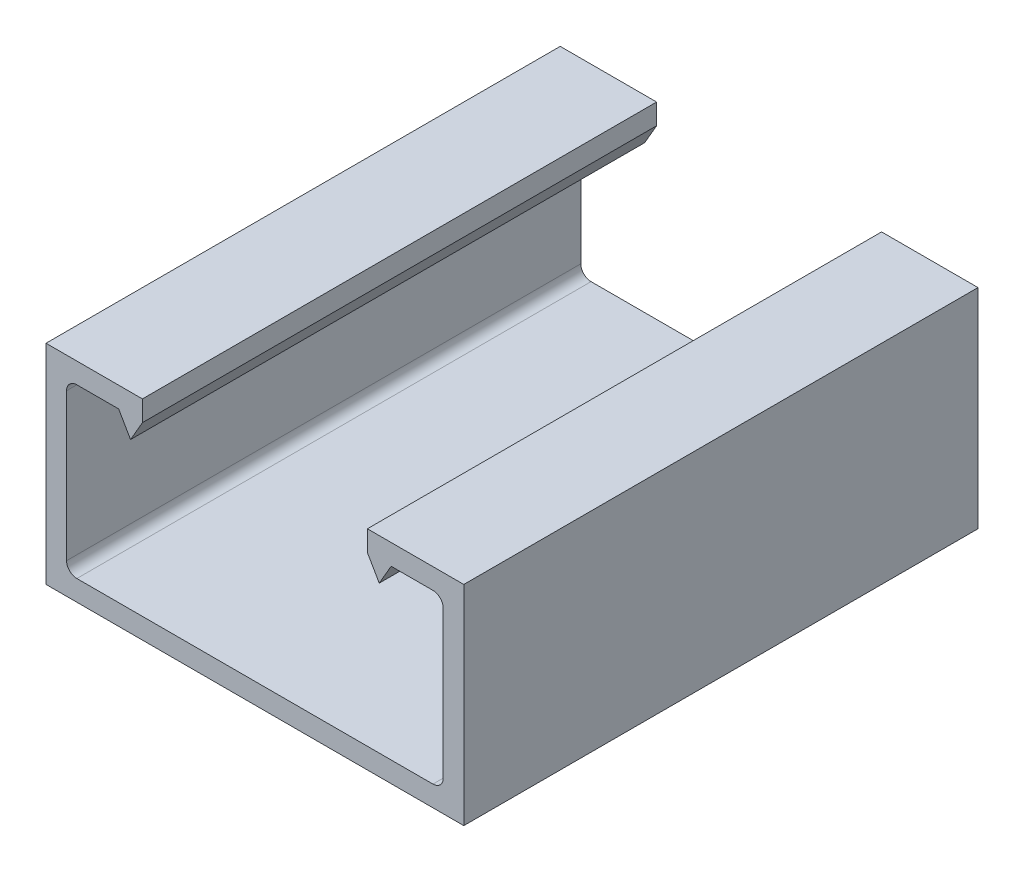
SolidWorks part; units mm, degrees
ref_plane "Plane1" through (0, 0, 0) normal (0, 0, 1) x (1, 0, 0)
ref_plane "Plane2" through (0, 0, 0) normal (0, 1, 0) x (1, 0, 0)
ref_plane "Plane3" through (0, 0, 0) normal (1, 0, 0) x (0, 0, -1)
sketch "Sketch1" plane through (0, 0, 0) normal (0, 0, 1) x (1, 0, 0)
  line L0 (-5.5563, 5.1594) -> (-10.3187, 5.1594)
  line L1 (-10.3187, 5.1594) -> (-10.3187, -5.1594)
  line L2 (-10.3187, -5.1594) -> (10.3188, -5.1594)
  line L3 (10.3188, -5.1594) -> (10.3187, 5.1594)
  line L4 (10.3187, 5.1594) -> (5.5562, 5.1594)
  line L5 (8.7948, 4.1434) -> (6.7294, 4.1434)
  line L6 (9.3028, -3.6354) -> (9.3027, 3.6354)
  line L7 (-8.7948, -4.1434) -> (8.7948, -4.1434)
  line L8 (-9.3028, 3.6354) -> (-9.3027, -3.6354)
  line L9 (-6.7294, 4.1434) -> (-8.7948, 4.1434)
  line L10 (6.7294, 4.1434) -> (6.1428, 3.1274)
  line L11 (6.1428, 3.1274) -> (5.5562, 4.1434)
  line L12 (5.5562, 4.1434) -> (5.5562, 5.1594)
  line L13 (-6.7294, 4.1434) -> (-6.1428, 3.1274)
  line L14 (-6.1428, 3.1274) -> (-5.5563, 4.1434)
  line L15 (-5.5563, 4.1434) -> (-5.5563, 5.1594)
  arc A0 (-9.3027, -3.6354) -> (-8.7948, -4.1434) centre (-8.7948, -3.6354) ccw
  arc A1 (-8.7948, 4.1434) -> (-9.3028, 3.6354) centre (-8.7948, 3.6354) ccw
  arc A2 (9.3027, 3.6354) -> (8.7948, 4.1434) centre (8.7948, 3.6354) ccw
  arc A3 (8.7948, -4.1434) -> (9.3028, -3.6354) centre (8.7948, -3.6354) ccw
  dimension "D5" = 0.508
  dimension "D4" = 60
  dimension "Width" = 20.6375
  dimension "Height" = 10.3187
  dimension "D8" = 10.3187
  dimension "D9" = 5.1594
  dimension "D10" = 11.1125
  dimension "edge" = 4.7625
  dimension "D13" = 0.5866
extrude "Base-Extrude" add sketch "Sketch1" along normal mid plane 25.4
equation "\"D8@Sketch1\" = \"Width@Sketch1\" / 2"
equation "\"D9@Sketch1\" = \"Height@Sketch1\" / 2"
equation "\"D10@Sketch1\" = \"Width@Sketch1\" - 2 * \"edge@Sketch1\""
equation "\"D5@Sketch1\" = \"gauge@Sketch1\" / 2"
equation "\"D13@Sketch1\" = \"gauge@Sketch1\" * .577350269"
